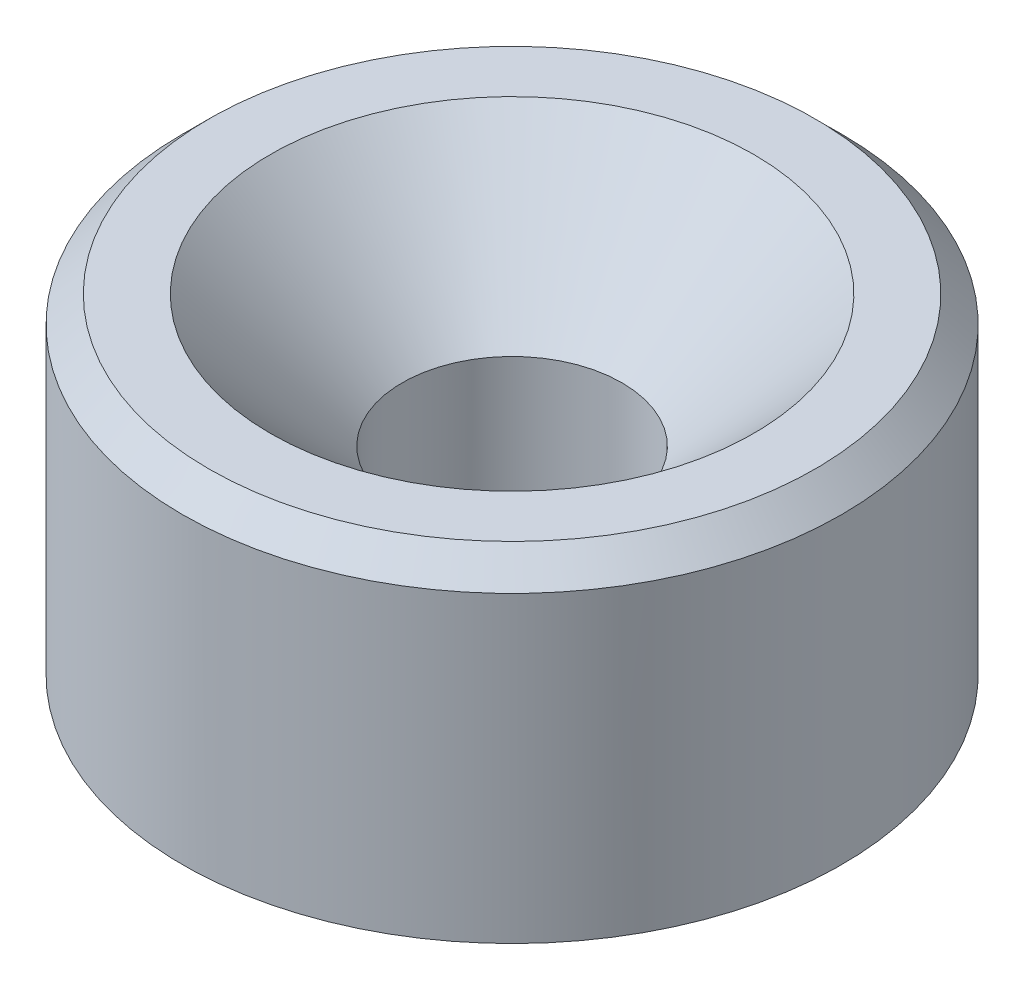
SolidWorks part; units mm, degrees
ref_plane "Front Plane" through (0, 0, 0) normal (0, 0, 1) x (1, 0, 0)
ref_plane "Top Plane" through (0, 0, 0) normal (0, 1, 0) x (1, 0, 0)
ref_plane "Right Plane" through (0, 0, 0) normal (1, 0, 0) x (0, 0, -1)
sketch "Sketch3" plane through (0, 0, 0) normal (0, 0, 1) x (1, 0, 0)
  line L0 (0, 0) -> (0, 2.54)
  line L1 (0, 0) -> (9.525, 0)
  line L2 (9.525, 0) -> (9.525, 9.525)
  line L3 (0, 2.54) -> (6.985, 9.525)
  line L4 (6.985, 9.525) -> (9.525, 9.525)
  dimension "D1" = 9.525
  dimension "D2" = 2.54
  dimension "D3" = 45
  dimension "D4" = 2.54
revolve "Revolve1" add sketch "Sketch3" angle 360 about L0
sketch "Sketch4" plane through (0, 0, 0) normal (0, -1, 0) x (1, 0, 0)
  circle A0 centre (0, 0) radius 3.175
  dimension "D1" = 6.35
extrude "Cut-Extrude1" cut sketch "Sketch4" against normal through all
chamfer "Chamfer1" distance 0.762 angle 45 1 edges at (0, 9.525, -9.525)
